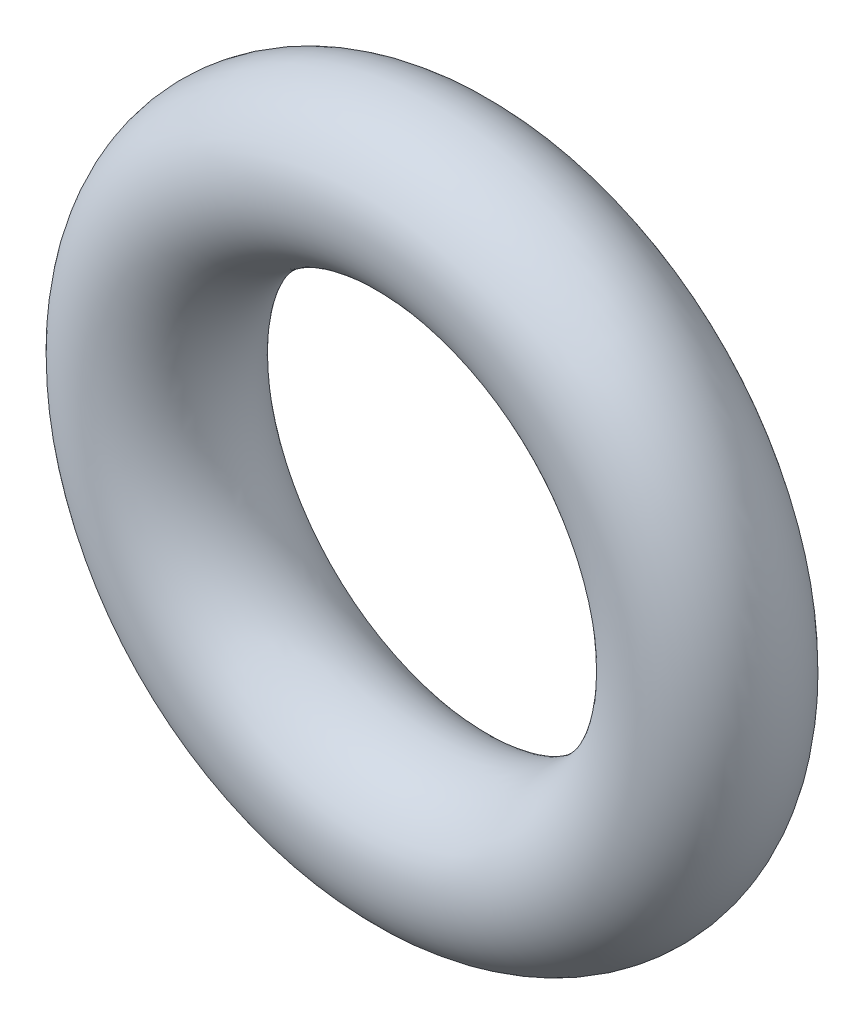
SolidWorks part; units mm, degrees
ref_plane "Front" through (0, 0, 0) normal (0, 0, 1) x (1, 0, 0)
ref_plane "Top" through (0, 0, 0) normal (0, 1, 0) x (1, 0, 0)
ref_plane "Right" through (0, 0, 0) normal (1, 0, 0) x (0, 0, -1)
sketch "Sketch1" plane through (0, 0, 0) normal (1, 0, 0) x (0, -1, 0)
  line L0 (0, -0.889) -> (0, 0.889) construction
  line L2 (-4.4145, 0) -> (4.4145, 0) construction
  line L3 (-2.2352, 0) -> (2.2352, 0) construction
  circle A0 centre (3.1242, 0) radius 0.889
  point P9 (2.2352, 0)
  point P10 (4.0132, 0)
  point P13 (3.1242, 0.889)
  point P14 (3.1242, -0.889)
  dimension "Width" = 1.778
  dimension "ID" = 4.4704
revolve "Revolve1" add sketch "Sketch1" angle 360 about L0
